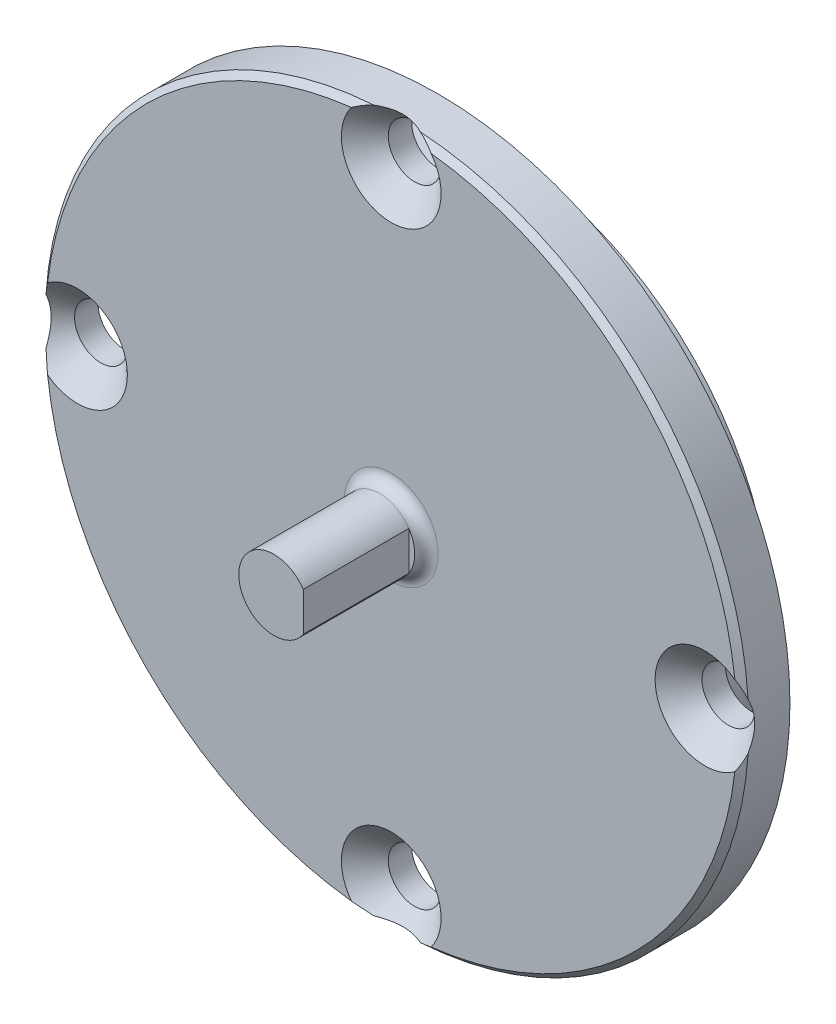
SolidWorks part; units mm, degrees
ref_plane "Plan1" through (0, 0, 0) normal (0, 0, 1) x (1, 0, 0)
ref_plane "Plan2" through (0, 0, 0) normal (0, 1, 0) x (1, 0, 0)
ref_plane "Plan3" through (0, 0, 0) normal (1, 0, 0) x (0, 0, -1)
sketch "Esquisse1" plane through (0, 0, 0) normal (0, 0, 1) x (1, 0, 0)
  line L0 (0, -69.2253) -> (0, 20.2603) construction
  line L1 (-38.5246, 0) -> (31.6168, 0) construction
  circle A1 centre (0, 0) radius 30
  dimension "D1" = 60
extrude "Base-Extrusion" add sketch "Esquisse1" along normal blind 4
sketch "Esquisse2" plane through (0, 0, 0) normal (0, 0, -1) x (-1, 0, 0)
  circle A0 centre (0, 0) radius 23.45
  circle A1 centre (0, 0) radius 19
  dimension "D1" = 46.9
  dimension "D2" = 38
extrude "Boss.-Extru.1" add sketch "Esquisse2" along normal blind 5
chamfer "Chanfrein1" distance 0.5 angle 45
sketch "Esquisse3" plane through (0, 0, 4) normal (0, 0, 1) x (1, 0, 0)
  circle A0 centre (0, 0) radius 3
  dimension "D1" = 6
extrude "Boss.-Extru.2" add sketch "Esquisse3" along normal blind 10
fillet "Congé1" radius 1
sketch "Esquisse4" plane through (0, 0, 0) normal (0, 1, 0) x (1, 0, 0)
  line L0 (2.5, -5) -> (3, -5)
  line L1 (2.5, -5) -> (2.5, -14)
  line L2 (3, -14) -> (2.5, -14)
  line L3 (3, -14) -> (3, -5)
  line L4 (-3, -14) -> (3, -14) construction
  line L5 (3, -14) -> (3, -5) construction
  line L6 (-3, -5) -> (-3, -14) construction
  dimension "D1" = 5.5
  dimension "D2" = 9
extrude "Enlèv. mat.-Extru.2" cut sketch "Esquisse4" against normal through all and the other way through all
sketch "Esquisse5" plane through (0, 0, -5) normal (0, 0, -1) x (-1, 0, 0)
  line L0 (17.3397, 0) -> (-17.3397, 0) construction
  line L1 (-11.3117, -11.3117) -> (46.2546, 46.2546) construction
  circle A2 centre (11.3137, 11.3137) radius 1.65
  dimension "D1" = 45
  dimension "D2" = 3.3
  dimension "D3" = 16
extrude "Enlèv. mat.-Extru.3" cut sketch "Esquisse5" against normal through all
hole_wizard "Perçage1" positions "Esquisse8" profile "Esquisse7" legacy
sketch "Esquisse8" plane through (0, 0, 4) normal (0, 0, 1) x (1, 0, 0)
  line L0 (0, 0) -> (0, 26.1096) construction
  line L1 (17.3397, 0) -> (-17.3397, 0) construction
  point P0 (0, 26.75)
  dimension "D1" = 26.75
  dimension "D2" = 90
sketch "Esquisse7" plane through (0, 26.75, 4) normal (1, 0, 0) x (0, -1, 0)
  line L0 (0, 0) -> (0, 10.3519)
  line L1 (0, 10.3519) -> (2.25, 9)
  line L2 (2.25, 9) -> (2.25, 2)
  line L3 (2.25, 2) -> (4.25, 0)
  line L4 (4.25, 0) -> (0, 0)
  line L5 (0, -14.3089) -> (0, 102.4216) construction
  line L6 (0, 10.3519) -> (-2.25, 9) construction
  line L7 (-2.25, 2) -> (-4.25, 0) construction
  dimension "Diamètre" = 4.5
  dimension "Profondeur" = 9
  dimension "Diamètre fraisé" = 8.5
  dimension "Angle fraisé" = 90
  dimension "Angle" = 118
pattern_circular "Répétition circulaire1" count 4 every 90
pattern_circular "Répétition circulaire2" count 4 every 90
fillet "Congé2" radius 0.3
